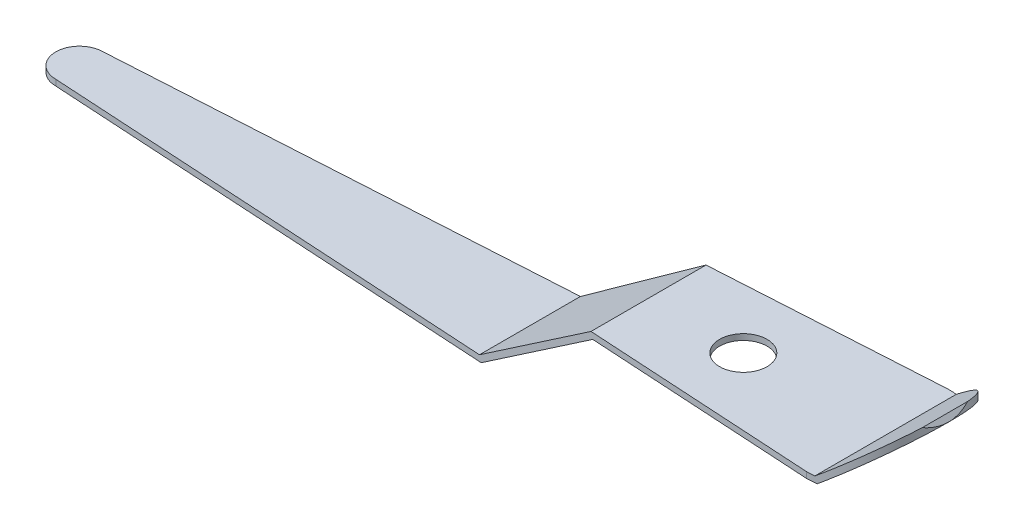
SolidWorks part; units mm, degrees
ref_plane "Plan de face" through (0, 0, 0) normal (0, 0, 1) x (1, 0, 0)
ref_plane "Plan de dessus" through (0, 0, 0) normal (0, 1, 0) x (1, 0, 0)
ref_plane "Plan de droite" through (0, 0, 0) normal (1, 0, 0) x (0, 0, -1)
sketch "Esquisse1" plane through (0, 0, 0) normal (0, 0, 1) x (1, 0, 0)
  line L0 (0, 0) -> (40, 0)
  line L1 (40, 0) -> (50, 7)
  line L2 (50, 7) -> (70, 7)
  line L3 (70, 7) -> (75, 11)
  line L4 (0, -0.5) -> (40.1576, -0.5)
  line L5 (40.1576, -0.5) -> (50.1576, 6.5)
  line L6 (50.1576, 6.5) -> (70.1754, 6.5)
  line L7 (70.1754, 6.5) -> (75.3123, 10.6096)
  line L8 (0, -0.5) -> (0, 0)
  line L9 (75, 11) -> (75.3123, 10.6096)
  dimension "D1" = 40
  dimension "D2" = 10
  dimension "D3" = 20
  dimension "D4" = 5
  dimension "D5" = 7
  dimension "D6" = 4
  dimension "D7" = 0.5
extrude "Extrusion1" add sketch "Esquisse1" along normal blind 12
sketch "Esquisse2" plane through (0, 0, 0) normal (0, 1, 0) x (1, 0, 0)
  line L0 (0, -6) -> (75, -6) construction
  line L2 (0, -12) -> (0, 0) construction
  line L3 (75, -12) -> (75, 0) construction
  line L4 (2, -4) -> (69.3123, 0)
  line L5 (69.3123, -12) -> (2, -8)
  arc A2 (69.3123, 0) -> (69.3123, -12) centre (69.3123, -6) cw
  arc A3 (2, -4) -> (2, -8) centre (2, -6) ccw
extrude "Enlèv. mat.-Extru.1" cut sketch "Esquisse2" against normal blind 12 and the other way blind 12 flip side to cut
sketch "Esquisse3" plane through (0, 7, 0) normal (0, 1, 0) x (-1, 0, 0)
  line L0 (-50, 6) -> (-70, 6) construction
  line L1 (-50, 10.8524) -> (-50, 1.1476) construction
  line L2 (-70, 11.9605) -> (-70, 0.0395) construction
  circle A0 centre (-58, 6) radius 2
  dimension "D1" = 8
extrude "Enlèv. mat.-Extru.2" cut sketch "Esquisse3" against normal through all
